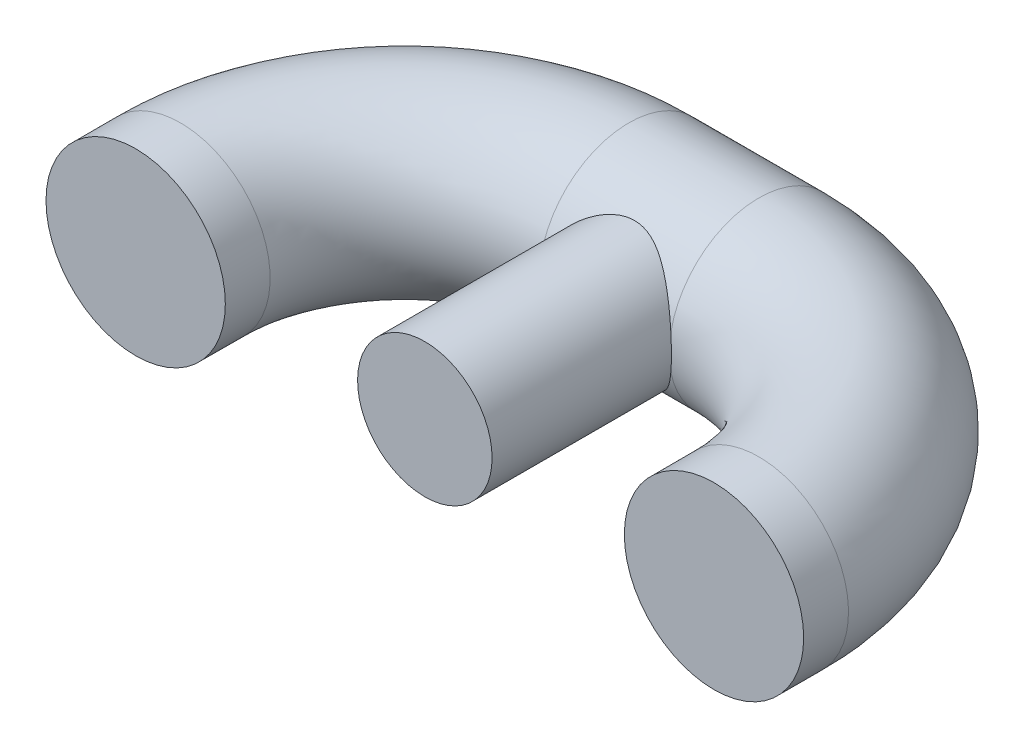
SolidWorks part; units mm, degrees
ref_plane "Front Plane" through (0, 0, 0) normal (0, 0, 1) x (1, 0, 0)
ref_plane "Top Plane" through (0, 0, 0) normal (0, 1, 0) x (1, 0, 0)
ref_plane "Right Plane" through (0, 0, 0) normal (1, 0, 0) x (0, 0, -1)
sketch "Sketch1" plane through (0, 0, 0) normal (0, 0, 1) x (1, 0, 0)
  line L0 (1.1176, 0) -> (-1.1176, 0) construction
  line L1 (1.6383, 0) -> (0, 0) construction
  line L2 (0, 0) -> (-1.6383, 0) construction
  circle A0 centre (0, 0) radius 0.381
  circle A1 centre (1.6383, 0) radius 0.508
  circle A2 centre (-1.6383, 0) radius 0.508
  dimension "D1" = 3.2766
  dimension "D2" = 1.016
  dimension "D3" = 0.762
extrude "Boss-Extrude1" add sketch "Sketch1" along normal blind 0.254
sketch "Sketch2" plane through (0, 0, 0) normal (0, 0, -1) x (-1, 0, 0)
  line L0 (-0.3683, 1.8783) -> (-0.3683, -3.0822) construction
  circle A1 centre (-1.6383, 0) radius 0.508
  circle A2 centre (-1.6383, 0) radius 0.508
  dimension "D2" = 1.27
  dimension "D1" = 0
revolve "Revolve1" add sketch "Sketch2" angle 90 about L0
sketch "Sketch3" plane through (0, 0, 0) normal (0, 0, -1) x (-1, 0, 0)
  line L0 (0.3683, 2.0868) -> (0.3683, -1.6919) construction
  circle A1 centre (1.6383, 0) radius 0.508
  circle A2 centre (1.6383, 0) radius 0.508
  dimension "D2" = 1.27
  dimension "D1" = 0
revolve "Revolve2" add sketch "Sketch3" angle 90 about L0
sketch "Sketch4" plane through (0.3683, 0, 0) normal (-1, 0, 0) x (0, 0, 1)
  circle A1 centre (-1.27, 0) radius 0.508
  circle A2 centre (-1.27, 0) radius 0.508
  dimension "D1" = 0
extrude "Boss-Extrude2" add sketch "Sketch4" along normal up to next
sketch "Sketch5" plane through (0, 0, 0) normal (0, 0, -1) x (-1, 0, 0)
  circle A1 centre (0, 0) radius 0.381
  circle A2 centre (0, 0) radius 0.381
  dimension "D1" = 0
extrude "Boss-Extrude3" add sketch "Sketch5" along normal blind 1.27
